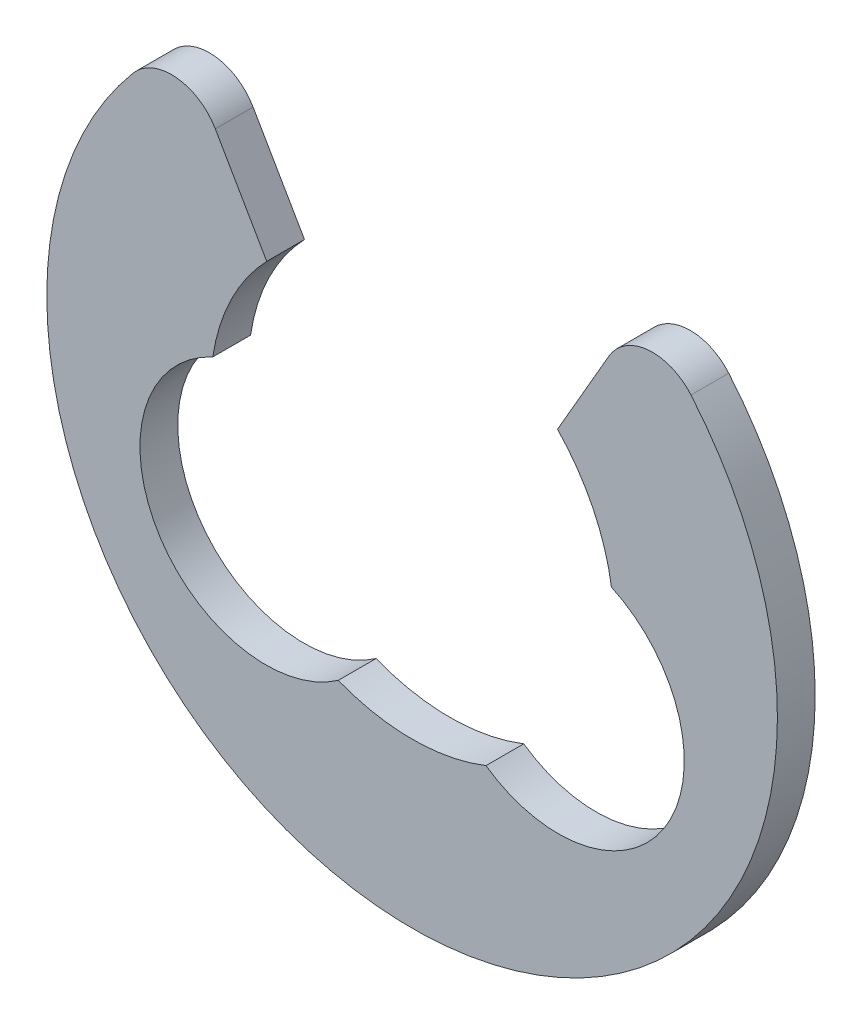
SolidWorks part; units mm, degrees
ref_plane "Plan de face" through (0, 0, 0) normal (0, 0, 1) x (1, 0, 0)
ref_plane "Plan de dessus" through (0, 0, 0) normal (0, 1, 0) x (1, 0, 0)
ref_plane "Plan de droite" through (0, 0, 0) normal (1, 0, 0) x (0, 0, -1)
sketch "Esquisse1" plane through (0, 0, 0) normal (0, 0, 1) x (1, 0, 0)
  line L0 (0, 0) -> (0, 14.5) construction
  line L1 (-5.7713, 5.54) -> (-9.0935, 11.2942)
  line L2 (5.7713, 5.54) -> (9.0935, 11.2942)
  line L3 (0, 0) -> (-12.5574, -7.25) construction
  line L4 (0, 0) -> (12.5574, -7.25) construction
  arc A0 (-2.9314, -7.4436) -> (2.9314, -7.4436) centre (0, 0) ccw
  arc A1 (-9.0935, 11.2942) -> (9.0935, 11.2942) centre (0, 0) ccw
  arc A2 (-7.912, 1.1831) -> (-2.9314, -7.4436) centre (-5.8024, -3.35) ccw
  arc A3 (2.9314, -7.4436) -> (7.912, 1.1831) centre (5.8024, -3.35) ccw
  arc A4 (-5.7713, 5.54) -> (-7.912, 1.1831) centre (0, 0) ccw
  arc A5 (7.912, 1.1831) -> (5.7713, 5.54) centre (0, 0) ccw
  dimension "D1" = 16
  dimension "D2" = 29
  dimension "D5" = 60
  dimension "D6" = 5
  dimension "D3" = 120
  dimension "D4" = 120
  dimension "D7" = 6.7
  dimension "D8" = 5.54
extrude "Boss.-Extru.1" add sketch "Esquisse1" along normal blind 1.5
fillet "Congé1" radius 2 2 edges at (9.0935, 11.2942, 0.75) (-9.0935, 11.2942, 0.75)
